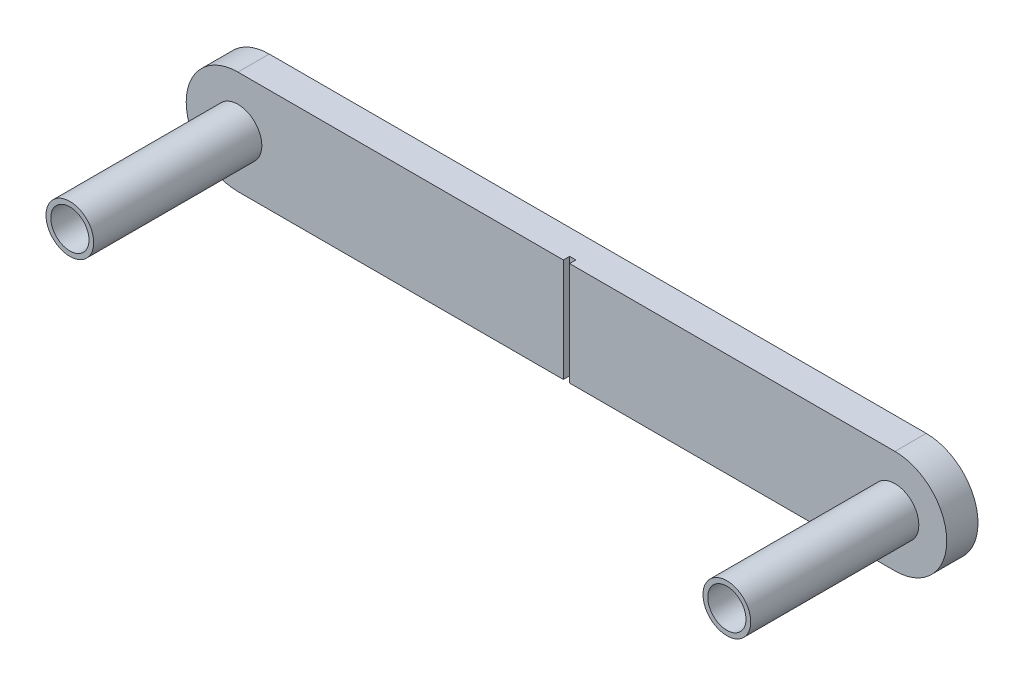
SolidWorks part; units mm, degrees
ref_plane "Plan1" through (0, 0, 0) normal (0, 0, 1) x (1, 0, 0)
ref_plane "Plan2" through (0, 0, 0) normal (0, 1, 0) x (1, 0, 0)
ref_plane "Plan3" through (0, 0, 0) normal (1, 0, 0) x (0, 0, -1)
sketch "Esquisse7" plane through (0, 0, 0) normal (0, 0, 1) x (1, 0, 0)
  circle A0 centre (353.5953, 142.141) radius 7.625
  dimension "D1" = 15.25
extrude "Base-Extrusion" add sketch "Esquisse7" against normal blind 53.73
sketch "Esquisse8" plane through (0, 0, -53.73) normal (0, 0, -1) x (-1, 0, 0)
  line L0 (-143.5953, 158.6847) -> (-353.5953, 158.6847)
  line L1 (-353.5953, 125.5972) -> (-143.5953, 125.5972)
  arc A0 (-353.5953, 158.6847) -> (-353.5953, 125.5972) centre (-353.5953, 142.141) ccw
  arc A1 (-143.5953, 158.6847) -> (-143.5953, 125.5972) centre (-143.5953, 142.141) cw
  dimension "D1" = 210
extrude "Boss.-Extru.1" add sketch "Esquisse8" along normal blind 10
sketch "Esquisse10" plane through (0, 0, -53.73) normal (0, 0, 1) x (1, 0, 0)
  circle A0 centre (143.5953, 142.141) radius 7.625
  dimension "D1" = 15.25
extrude "Boss.-Extru.2" add sketch "Esquisse10" along normal blind 53.73
sketch "Esquisse11" plane through (0, 0, -53.73) normal (0, 0, 1) x (1, 0, 0)
  line L0 (247.5953, 158.6847) -> (249.5953, 158.6847)
  line L2 (247.5953, 125.2146) -> (249.5953, 125.2146)
  line L3 (247.5953, 158.6847) -> (247.5953, 125.2146)
  line L4 (249.5953, 158.6847) -> (249.5953, 125.2146)
extrude "Enlèv. mat.-Extru.2" cut sketch "Esquisse11" against normal blind 2
sketch "Esquisse12" plane through (0, 0, 0) normal (0, 0, 1) x (1, 0, 0)
  circle A0 centre (143.5953, 142.141) radius 6.11
  circle A1 centre (353.5953, 142.141) radius 6.11
  dimension "D1" = 12.22
  dimension "D2" = 12.22
extrude "Enlèv. mat.-Extru.3" cut sketch "Esquisse12" against normal through all
